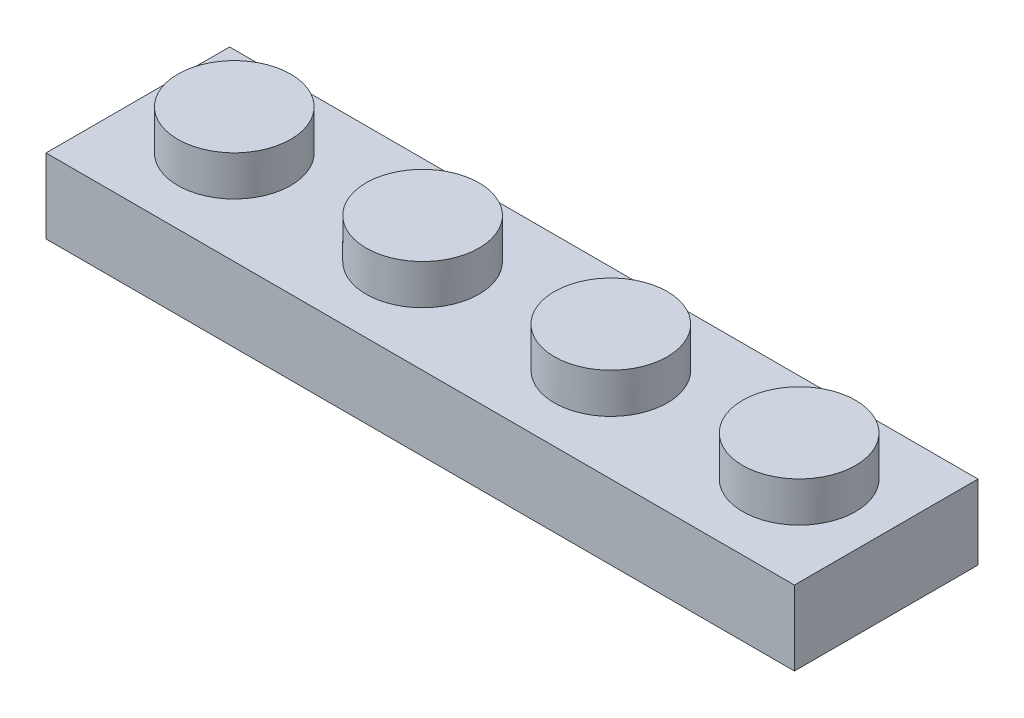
SolidWorks part; units mm, degrees
ref_plane "Front Plane" through (0, 0, 0) normal (0, 0, 1) x (1, 0, 0)
ref_plane "Top Plane" through (0, 0, 0) normal (0, 1, 0) x (1, 0, 0)
ref_plane "Right Plane" through (0, 0, 0) normal (1, 0, 0) x (0, 0, -1)
sketch "Sketch1" plane through (0, 0, 0) normal (0, 1, 0) x (1, 0, 0)
  line L1 (0, 0) -> (31.8, 0)
  line L2 (0, 0) -> (0, 7.8)
  line L3 (0, 7.8) -> (31.8, 7.8)
  line L4 (31.8, 0) -> (31.8, 7.8)
  dimension "D1" = 31.8
  dimension "D2" = 7.8
extrude "Extrude1" add sketch "Sketch1" along normal blind 3.166
sketch "Sketch2" plane through (0, 3.166, 0) normal (0, 1, 0) x (1, 0, 0)
  circle A0 centre (4, 4) radius 2.4
  point P6 (9.3567, 6.1688)
  dimension "D1" = 4.8
extrude "Extrude2" add sketch "Sketch2" along normal blind 1.7
sketch "Sketch3" plane through (0, 0, 0) normal (0, -1, 0) x (1, 0, 0)
  line L0 (31.8, 0) -> (31.8, -7.8) construction
  line L1 (25.55, -1.55) -> (30.35, -1.55)
  line L2 (25.55, -1.55) -> (25.55, -6.35)
  line L3 (25.55, -6.35) -> (30.35, -6.35)
  line L4 (30.35, -1.55) -> (30.35, -6.35)
  line L5 (31.8, -7.8) -> (0, -7.8) construction
  dimension "D1" = 4.8
  dimension "D2" = 1.45
  dimension "D3" = 1.45
extrude "Extrude3" cut sketch "Sketch3" against normal blind 1.75
sketch "Sketch4" plane through (0, 3.166, 0) normal (0, 1, 0) x (1, 0, 0)
  line L0 (0, 3.9) -> (35.7528, 3.9) construction
  line L1 (0, 7.8) -> (0, 0) construction
pattern_linear "LPattern1" count 4 spacing 8 along (1, 0, 0) of "Extrude2"
pattern_linear "LPattern2" count 4 spacing 8 along (-1, 0, 0) of "Extrude3"
